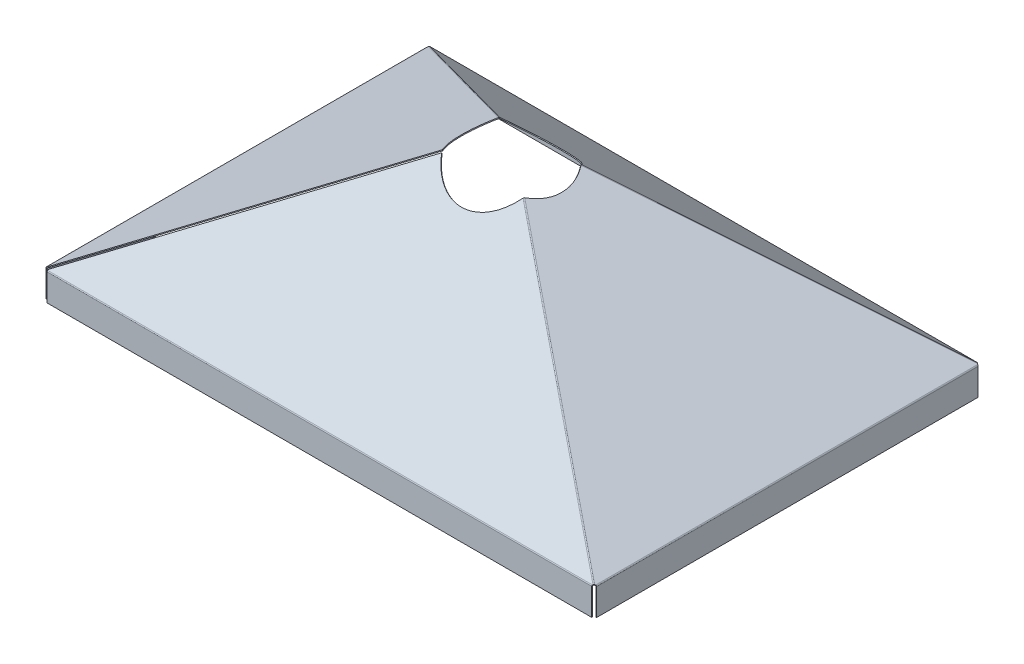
SolidWorks part; units mm, degrees
ref_plane "Ebene vorne" through (0, 0, 0) normal (0, 0, 1) x (1, 0, 0)
ref_plane "Ebene oben" through (0, 0, 0) normal (0, 1, 0) x (1, 0, 0)
ref_plane "Ebene rechts" through (0, 0, 0) normal (1, 0, 0) x (0, 0, -1)
sketch "Skizze1" plane through (0, 0, 0) normal (0, 1, 0) x (1, 0, 0)
  line L1 (-500, 350) -> (500, 350)
  line L2 (-500, 350) -> (-500, -350)
  line L3 (-500, -350) -> (500, -350)
  line L4 (500, 350) -> (500, -350)
  point P4 (0, -350)
  point P6 (500, 0)
  dimension "D1" = 1000
  dimension "D2" = 700
extrude "Linear austragen1" add sketch "Skizze1" along normal blind 300
sketch "Skizze2" plane through (0, 300, 0) normal (0, 1, 0) x (1, 0, 0)
  line L0 (-500, 350) -> (500, -350) construction
  line L1 (-73.7309, 51.6116) -> (-73.7309, -350) construction
  line L2 (-500, -350) -> (500, -350) construction
  line L3 (-73.7309, 51.6116) -> (500, 51.6116) construction
  line L4 (500, -350) -> (500, 350) construction
  circle A0 centre (0, 0) radius 90 construction
  dimension "D1" = 180
sketch "Skizze3" plane through (0, 0, 350) normal (0, 0, 1) x (1, 0, 0)
  line L0 (-73.7309, 300) -> (-500, 50)
  line L1 (-500, 300) -> (-500, 0) construction
  line L2 (-500, 0) -> (500, 0) construction
  dimension "D1" = 50
extrude "Schnitt-Linear austragen1" cut sketch "Skizze3" against normal through all and the other way through all flip side to cut
sketch "Skizze4" plane through (500, 0, 0) normal (1, 0, 0) x (0, 0, -1)
  line L0 (51.6116, 300) -> (350, 50)
  line L1 (350, 300) -> (350, 0) construction
  line L2 (-350, 0) -> (350, 0) construction
  dimension "D1" = 50
extrude "Schnitt-Linear austragen2" cut sketch "Skizze4" against normal through all and the other way through all
mirror "Spiegeln1" about plane through (0, 0, 0) normal (1, 0, 0) of "Schnitt-Linear austragen1"
mirror "Spiegeln2" about plane through (0, 0, 0) normal (0, 0, 1) of "Schnitt-Linear austragen2"
shell "Wandung1" thickness 1.5
ref_plane "Ebene1" through (0, 300, 0) normal (0, 1, 0) x (-1, 0, 0)
sketch "Skizze22" plane through (0, 300, 0) normal (0, 1, 0) x (-1, 0, 0)
  circle A0 centre (0, 0) radius 90 construction
  circle A1 centre (0, 0) radius 90
extrude "Schnitt-Linear austragen7" cut sketch "Skizze22" against normal blind 300
sketch "Skizze8" plane through (0, 300, 0) normal (0, 1, 0) x (-1, 0, 0)
  line L0 (500, 350) -> (73.7309, 51.6116) construction
  line L1 (500, 350) -> (73.7309, 51.6116) construction
  line L2 (492.2886, 347.0433) -> (50.036, 37.4665)
  line L3 (495.3279, 344.2882) -> (53.0159, 34.6698)
  line L4 (498.8531, 351.6385) -> (72.5839, 53.2501) construction
  line L5 (501.1469, 348.3615) -> (74.8778, 49.9731) construction
  line L6 (53.0159, 34.6698) -> (50.036, 37.4665)
  line L8 (502.5834, 344.2882) -> (495.3279, 344.2882)
  line L9 (502.5834, 344.2882) -> (502.5834, 354.9063)
  line L10 (0, -49.276) -> (0, -121.6845) construction
  line L11 (502.5834, 354.9063) -> (492.2886, 354.9063)
  line L12 (492.2886, 347.0433) -> (492.2886, 354.9063)
  line L14 (-70.7658, -49.276) -> (70.7658, -49.276) construction
  line L15 (-73.7309, 0) -> (-138.8356, 0) construction
  line L16 (-73.7309, 51.6116) -> (-73.7309, -51.6116) construction
  line L17 (-502.5834, 354.9063) -> (-492.2886, 354.9063)
  line L18 (-496.7813, 347.6581) -> (-492.2886, 354.9063)
  line L19 (-502.5834, 344.2882) -> (-496.7813, 347.6581)
  line L20 (-502.5834, 344.2882) -> (-502.5834, 354.9063)
  line L21 (502.5834, -344.2882) -> (496.7813, -347.6581)
  line L22 (502.5834, -344.2882) -> (502.5834, -354.9063)
  line L23 (502.5834, -354.9063) -> (492.2886, -354.9063)
  line L24 (496.7813, -347.6581) -> (492.2886, -354.9063)
  line L25 (-502.5834, -344.2882) -> (-502.5834, -354.9063)
  line L26 (-502.5834, -344.2882) -> (-496.7813, -347.6581)
  line L27 (-496.7813, -347.6581) -> (-492.2886, -354.9063)
  line L28 (-502.5834, -354.9063) -> (-492.2886, -354.9063)
  dimension "D1" = 2
  dimension "D2" = 2
extrude "Schnitt-Linear austragen6" cut sketch "Skizze8" against normal through all
sheet metal parameters "Blech4" parameters "D1"=1, "Dicke"=1.5
bend "Biegung-Winkel23" bend angle 48.609 parameters "D1"=0, "D5"=1
flatten bends "Abwickeln4" parameters "D1"=0
sketch "Skizze-Winkel4" plane through (0, 201.6738, 168.9692) normal (0, 0.7665, 0.6422) x (-1, 0, 0)
  line L0 (-74.0489, -152.2899) -> (-497.1111, 234.0572) construction
  line L1 (-94.2663, -253.6651) -> (-633.1678, -448.1666) construction
  line L2 (42.5016, -310.4762) -> (284.9935, -829.5556) construction
  line L3 (672.3059, -255.952) -> (287.5761, -829.879) construction
  line L4 (283.5503, -830.8098) -> (-633.038, -450.0742) construction
  line L5 (-635.2194, -446.565) -> (-499.6201, 233.3651) construction
  line L6 (-496.2594, 235.7691) -> (492.2886, 235.7691) construction
bend "Biegung-Winkel17" bend angle 50.043 parameters "D1"=0, "D5"=7
bend "Biegung-Winkel18" bend angle 59.609 parameters "D1"=0, "D5"=6
bend "Biegung-Winkel19" bend angle 50.043 parameters "D1"=0, "D5"=5
bend "Biegung-Winkel20" bend angle 59.609 parameters "D1"=0, "D5"=4
bend "Biegung-Winkel21" bend angle 48.609 parameters "D1"=0, "D5"=3
bend "Biegung-Winkel22" bend angle 48.609 parameters "D1"=0, "D5"=2
process bends "Abbiegen4" parameters "D1"=0
sketch "Abwicklung-Skizze4" plane through (0, 201.6738, 168.9692) normal (0, 0.7665, 0.6422) x (-1, 0, 0)
flat pattern "Abwicklung4"
sketch "Biegung-Linien4" plane through (0, 201.6738, 168.9692) normal (0, 0.7665, 0.6422) x (-1, 0, 0)
  line L0 (-495.521, 235.7691) -> (492.2886, 235.7691) construction
  line L1 (-635.1002, -445.967) -> (-499.7394, 232.7671) construction
  line L2 (282.8684, -830.5265) -> (-632.3561, -450.3575) construction
  line L3 (287.9156, -829.3724) -> (672.3059, -255.952) construction
  line L4 (41.9907, -309.3824) -> (284.7186, -828.9671) construction
  line L5 (-93.1307, -253.2552) -> (-632.5568, -447.9461) construction
  line L6 (-73.1574, -153.104) -> (-496.6314, 233.6192) construction
  line L7 (-495.521, 235.7691) -> (492.2886, 235.7691) construction
  line L8 (-635.1002, -445.967) -> (-499.7394, 232.7671) construction
  line L9 (282.8684, -830.5265) -> (-632.3561, -450.3575) construction
  line L10 (287.9156, -829.3724) -> (672.3059, -255.952) construction
  line L11 (41.9907, -309.3824) -> (284.7186, -828.9671) construction
  line L12 (-93.1307, -253.2552) -> (-632.5568, -447.9461) construction
  line L13 (-73.1574, -153.104) -> (-496.6314, 233.6192) construction
bend of the flat pattern "Abwickeln-<Biegung-Winkel17>1"
bend of the flat pattern "Abwickeln-<Biegung-Winkel18>1"
bend of the flat pattern "Abwickeln-<Biegung-Winkel19>1"
bend of the flat pattern "Abwickeln-<Biegung-Winkel20>1"
bend of the flat pattern "Abwickeln-<Biegung-Winkel21>1"
bend of the flat pattern "Abwickeln-<Biegung-Winkel22>1"
bend of the flat pattern "Abwickeln-<Biegung-Winkel23>1"
